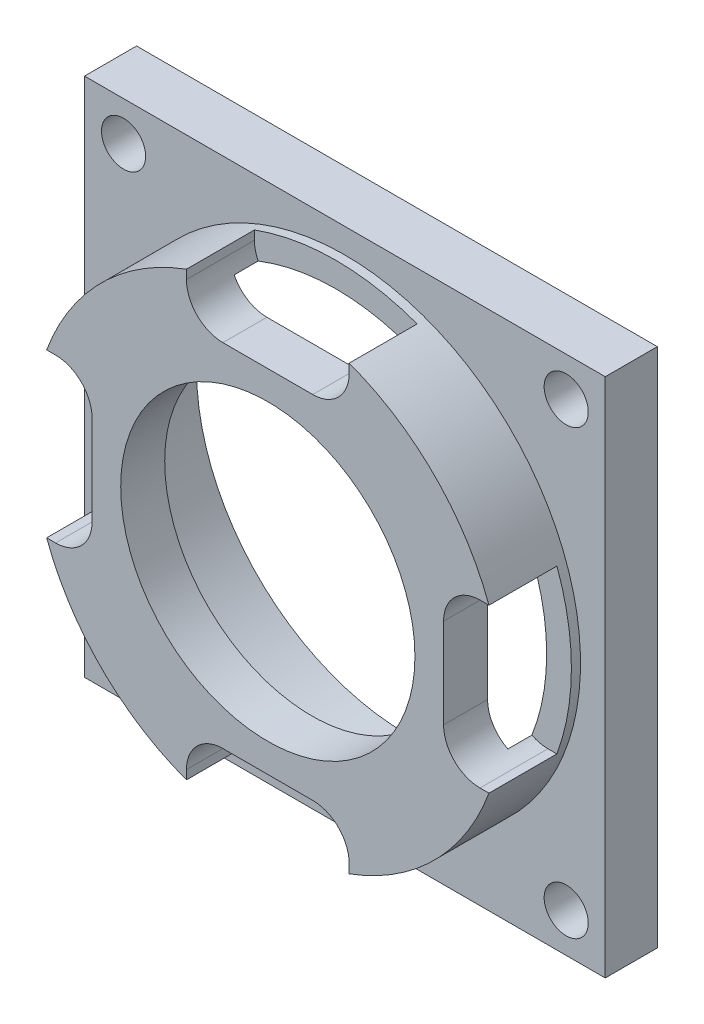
SolidWorks part; units mm, degrees
ref_plane "Front" through (0, 0, 0) normal (0, 0, 1) x (1, 0, 0)
ref_plane "Top" through (0, 0, 0) normal (0, 1, 0) x (1, 0, 0)
ref_plane "Right" through (0, 0, 0) normal (1, 0, 0) x (0, 0, -1)
sketch "Sketch1" plane through (0, 0, 0) normal (0, 0, 1) x (1, 0, 0)
  circle A1 centre (0, 0) radius 22.987
  dimension "D2" = 45.974
extrude "Extrude1" add sketch "Sketch1" along normal blind 24.13
sketch "Sketch3" plane through (0, 0, 0) normal (0, 0, -1) x (-1, 0, 0)
  circle A0 centre (0, 0) radius 20.574
  dimension "D1" = 41.148
extrude "Cut-Extrude1" cut sketch "Sketch3" against normal blind 13.716
sketch "Sketch10" plane through (0, 0, 0) normal (0, 0, 1) x (1, 0, 0)
  circle A0 centre (0, 0) radius 14.351
  dimension "D1" = 28.702
extrude "Cut-Extrude4" cut sketch "Sketch10" along normal through all
sketch "Sketch11" plane through (0, 0, 24.13) normal (0, 0, 1) x (1, 0, 0)
  circle A0 centre (0, 0) radius 17.2339 construction
  circle A1 centre (0, 0) radius 30.8642
  dimension "D1" = 34.4678
extrude "Cut-Extrude5" cut sketch "Sketch11" against normal offset from surface (6.1214 mm away) 4.2926
sketch "Sketch12" plane through (0, 0, 0) normal (0, 0, 1) x (1, 0, 0)
  circle A0 centre (0, 0) radius 37.1057
extrude "Cut-Extrude9" cut sketch "Sketch12" along normal blind 4.3942
ref_plane "Plane1" through (0, 0, 5.4102) normal (0, 0, -1) x (-1, 0, 0)
sketch "Sketch13" plane through (0, 0, 5.4102) normal (0, 0, -1) x (-1, 0, 0)
  line L1 (-25.4, 25.4) -> (25.4, 25.4)
  line L2 (-25.4, 25.4) -> (-25.4, -25.4)
  line L3 (-25.4, -25.4) -> (25.4, -25.4)
  line L4 (25.4, 25.4) -> (25.4, -25.4)
  circle A0 centre (0, 0) radius 22.987
  circle A1 centre (0, 0) radius 22.987 construction
  point P4 (0, 25.4)
  point P5 (-25.4, 0)
  dimension "D1" = 50.8
extrude "Extrude2" add sketch "Sketch13" against normal blind 5.08
hole_wizard "#18 (0.169500) Diameter Hole1" positions "Sketch15" profile "Sketch14" hole size "#18" standard "Ansi Inch"
sketch "Sketch15" plane through (0, 0, 10.4902) normal (0, 0, 1) x (1, 0, 0)
  line L0 (25.4, -25.4) -> (-25.4, -25.4) construction
  line L1 (25.4, 25.4) -> (25.4, -25.4) construction
  point P0 (21.59, -21.59)
  dimension "D1" = 3.81
  dimension "D2" = 3.81
sketch "Sketch14" plane through (21.59, -21.59, 10.4902) normal (1, 0, 0) x (0, -1, 0)
  line L0 (0, 0) -> (0, 6.096)
  line L1 (0, 6.096) -> (2.1526, 6.096)
  line L2 (2.1526, 6.096) -> (2.1526, 0)
  line L5 (2.1526, 0) -> (0, 0)
  line L11 (0, -6.35) -> (0, 107.95) construction
  dimension "Thru Hole Dia." = 4.3053
  dimension "Thru Hole Depth" = 6.096
pattern_circular "CirPattern1" count 4 over 360 about axis through (0, 0, 0) along (0, 0, 1) of "#18 (0.169500) Diameter Hole1"
sketch "Sketch16" plane through (0, 0, 18.0086) normal (0, 0, 1) x (1, 0, 0)
  line L1 (17.145, 7.9375) -> (26.4938, 7.9375)
  line L2 (17.145, 7.9375) -> (17.145, -7.9375)
  line L3 (17.145, -7.9375) -> (26.4938, -7.9375)
  line L4 (26.4938, 7.9375) -> (26.4938, -7.9375)
  point P4 (17.145, 0)
  dimension "D1" = 15.875
  dimension "D2" = 17.145
extrude "Cut-Extrude10" cut sketch "Sketch16" against normal offset from surface (6.6294 mm away) 0.889
fillet "Fillet1" radius 3.556 2 edges at (17.145, -7.9375, 15.8623) (17.145, 7.9375, 15.8623)
pattern_circular "CirPattern2" count 4 over 360 about axis through (0, 0, 0) along (0, 0, 1) of "Cut-Extrude10", "Fillet1"
